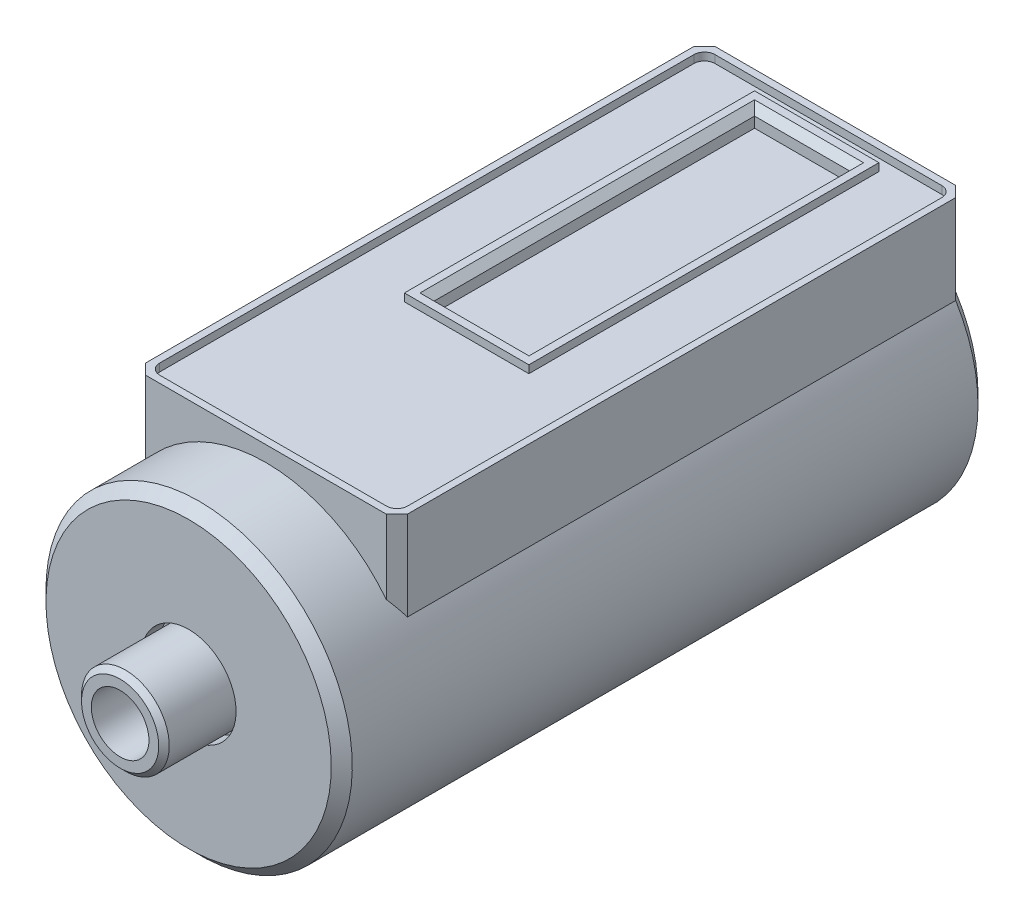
SolidWorks part; units mm, degrees
ref_plane "Front" through (0, 0, 0) normal (0, 0, 1) x (1, 0, 0)
ref_plane "Top" through (0, 0, 0) normal (0, 1, 0) x (1, 0, 0)
ref_plane "Right" through (0, 0, 0) normal (1, 0, 0) x (0, 0, -1)
sketch "Sketch2" plane through (0, 0, 0) normal (1, 0, 0) x (0, 0, -1)
  line L0 (21.335, 0) -> (21.335, 2.79)
  line L1 (21.715, 3.17) -> (27.555, 3.17)
  line L2 (26.285, 3.43) -> (26.285, 10.31)
  line L3 (27.045, 11.07) -> (73.025, 11.07)
  line L4 (73.025, 11.07) -> (73.025, 0)
  line L5 (73.025, 0) -> (21.335, 0)
  line L6 (26.285, 3.43) -> (27.555, 3.43)
  line L7 (27.555, 3.43) -> (27.555, 3.17)
  line L8 (21.335, 2.79) -> (21.715, 3.17)
  line L9 (26.285, 10.31) -> (27.045, 11.07)
  dimension "D1" = 51.69
  dimension "D2" = 3.17
  dimension "D3" = 11.07
  dimension "D4" = 4.95
  dimension "D5" = 1.27
  dimension "D6" = 3.43
  dimension "D7" = 2.79
  dimension "D8" = 0.38
  dimension "D9" = 0.76
  dimension "D10" = 10.31
  dimension "D11" = 73.025
revolve "Revolve1" add sketch "Sketch2" angle 360 about L5
sketch "Sketch3" plane through (0, 0, 0) normal (0, 1, 0) x (1, 0, 0)
  line L0 (11.07, 73.025) -> (-11.07, 73.025) construction
  line L1 (-9.46, 73.025) -> (9.46, 73.025)
  line L2 (-9.46, 73.025) -> (-9.46, 32.635)
  line L3 (-8.7, 31.875) -> (8.7, 31.875)
  line L4 (9.46, 73.025) -> (9.46, 32.635)
  line L5 (-9.46, 32.635) -> (-8.7, 31.875)
  line L6 (9.46, 32.635) -> (8.7, 31.875)
  point P1 (9.46, 31.875)
  point P2 (-9.46, 31.875)
  point P6 (0, 31.875)
  dimension "D1" = 41.15
  dimension "D2" = 18.92
extrude "Extrude1" add sketch "Sketch3" along normal blind 12.19
chamfer "Chamfer1" distance 0.76 angle 45 3 edges at (-9.46, 8.9696, -73.025) (0, -11.07, -73.025) (9.46, 8.9696, -73.025)
sketch "Sketch4" plane through (0, 12.19, 0) normal (0, 1, 0) x (1, 0, 0)
  line L0 (-8.7, 31.875) -> (8.7, 31.875) construction
  line L1 (-8.19, 72.515) -> (8.2, 72.515)
  line L2 (-8.95, 71.755) -> (-8.95, 33.145)
  line L3 (-8.19, 32.385) -> (8.2, 32.385)
  line L4 (8.96, 71.755) -> (8.96, 33.145)
  line L5 (-9.46, 32.635) -> (-9.46, 72.265) construction
  line L7 (-4.49, 71.675) -> (4.5, 71.675)
  line L8 (-4.49, 71.675) -> (-4.49, 46.375)
  line L9 (-4.49, 46.375) -> (4.5, 46.375)
  line L10 (4.5, 71.675) -> (4.5, 46.375)
  arc A0 (-8.95, 71.755) -> (-8.19, 72.515) centre (-8.19, 71.755) cw
  arc A1 (8.96, 71.755) -> (8.2, 72.515) centre (8.2, 71.755) ccw
  arc A2 (8.96, 33.145) -> (8.2, 32.385) centre (8.2, 33.145) cw
  arc A3 (-8.95, 33.145) -> (-8.19, 32.385) centre (-8.19, 33.145) ccw
  dimension "D5" = 0.76
  dimension "D1" = 17.91
  dimension "D2" = 40.13
  dimension "D3" = 0.51
  dimension "D4" = 0.51
  dimension "D6" = 0.84
  dimension "D7" = 4.46
  dimension "D8" = 4.46
  dimension "D9" = 25.3
extrude "Cut-Extrude1" cut sketch "Sketch4" against normal blind 0.56
sketch "Sketch5" plane through (0, 12.19, 0) normal (0, 1, 0) x (1, 0, 0)
  line L1 (-3.42, 70.605) -> (3.44, 70.605)
  line L2 (-3.42, 70.605) -> (-3.42, 47.445)
  line L3 (-3.42, 47.445) -> (3.44, 47.445)
  line L4 (3.44, 70.605) -> (3.44, 47.445)
  line L6 (4.5, 71.675) -> (-4.49, 71.675) construction
  line L7 (-4.49, 71.675) -> (-4.49, 46.375) construction
  point P4 (0.005, 71.675)
  dimension "D1" = 6.86
  dimension "D2" = 23.16
  dimension "D3" = 1.07
  dimension "D4" = 1.07
extrude "Cut-Extrude2" cut sketch "Sketch5" against normal blind 1.27
chamfer "Chamfer2" distance 0.51 angle 45 4 edges at (0.01, 12.19, -47.445) (3.44, 12.19, -59.025) (-3.42, 12.19, -59.025) (0.01, 12.19, -70.605)
hole_wizard "Hole1" positions "Sketch7" profile "Sketch6" legacy
sketch "Sketch7" plane through (0, 0, -21.335) normal (0, 0, 1) x (1, 0, 0)
  circle A0 centre (0, 0) radius 3.17 construction
  point P0 (0, 0)
sketch "Sketch6" plane through (0, 0, -21.335) normal (1, 0, 0) x (0, -1, 0)
  line L0 (0, 0) -> (0, 7.6015)
  line L1 (0, 7.6015) -> (2.0828, 6.35)
  line L2 (2.0828, 6.35) -> (2.0828, 0)
  line L4 (2.0828, 0) -> (0, 0)
  line L6 (0, 7.6015) -> (-2.0828, 6.35) construction
  line L7 (0, -4.2442) -> (0, 117.3081) construction
  dimension "Diameter" = 4.1656
  dimension "Depth" = 6.35
  dimension "Drill Angle" = 118
